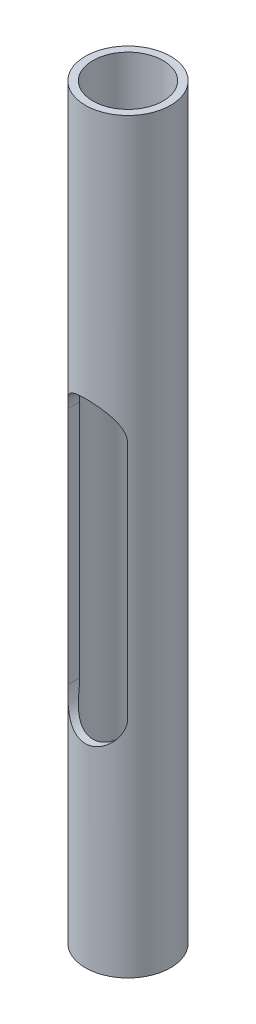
SolidWorks part; units mm, degrees
ref_plane "Plan de face" through (0, 0, 0) normal (0, 0, 1) x (1, 0, 0)
ref_plane "Plan de dessus" through (0, 0, 0) normal (0, 1, 0) x (1, 0, 0)
ref_plane "Plan de droite" through (0, 0, 0) normal (1, 0, 0) x (0, 0, -1)
sketch "Esquisse1" plane through (0, 0, 0) normal (0, 1, 0) x (1, 0, 0)
  circle A1 centre (0, 0) radius 57
  dimension "D1" = 114
extrude "Forme extérieure" add sketch "Esquisse1" along normal blind 1000
shell "Trou" thickness 10
sketch "Esquisse2" plane through (0, 0, 0) normal (0, 0, 1) x (1, 0, 0)
  line L0 (0, 620) -> (0, 300) construction
  line L1 (40, 620) -> (40, 300)
  line L2 (-40, 620) -> (-40, 300)
  arc A0 (40, 620) -> (-40, 620) centre (0, 620) ccw
  arc A1 (-40, 300) -> (40, 300) centre (0, 300) ccw
  point P3 (0, 460)
  dimension "D2" = 40
  dimension "D1" = 320
  dimension "D3" = 300
extrude "évidement trappe" cut sketch "Esquisse2" along normal up to next
